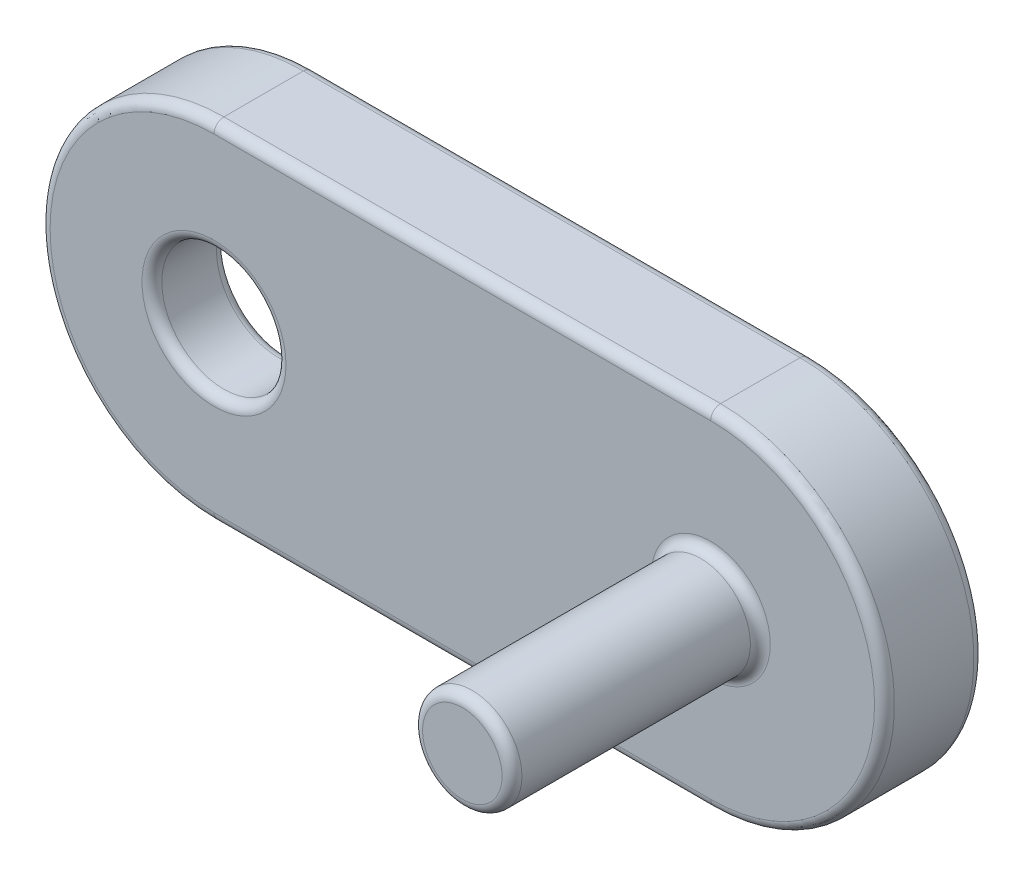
SolidWorks part; units mm, degrees
ref_plane "Face" through (0, 0, 0) normal (0, 0, 1) x (1, 0, 0)
ref_plane "Dessus" through (0, 0, 0) normal (0, 1, 0) x (1, 0, 0)
ref_plane "Droite" through (0, 0, 0) normal (1, 0, 0) x (0, 0, -1)
sketch "Esquisse1" plane through (0, 0, 0) normal (0, 0, 1) x (1, 0, 0)
  line L0 (0, 30.268) -> (0, -29.5682) construction
  line L1 (-5, 3.5) -> (5, 3.5)
  line L2 (-5, -3.5) -> (5, -3.5)
  arc A0 (-5, 3.5) -> (-5, -3.5) centre (-5, 0) ccw
  arc A1 (5, 3.5) -> (5, -3.5) centre (5, 0) cw
  point P10 (0, 3.5)
  point P13 (0, -3.5)
  dimension "D1" = 7
  dimension "D2" = 10
extrude "Extrusion1" add sketch "Esquisse1" along normal blind 2
sketch "Esquisse2" plane through (0, 0, 0) normal (0, 0, -1) x (-1, 0, 0)
  line L4 (5, 3) -> (-5, 3)
  line L5 (-5, -3) -> (5, -3)
  line L6 (5, 3) -> (-5, 3)
  line L7 (-5, -3) -> (5, -3)
  arc A4 (5, -3) -> (5, 3) centre (5, 0) ccw
  arc A5 (-5, 3) -> (-5, -3) centre (-5, 0) ccw
  arc A6 (5, -3) -> (5, 3) centre (5, 0) ccw
  arc A7 (-5, 3) -> (-5, -3) centre (-5, 0) ccw
  dimension "D1" = 0.5
extrude "Enlèv. mat.-Extru.1" cut sketch "Esquisse2" against normal blind 0.5
sketch "Esquisse3" plane through (0, 0, 0.5) normal (0, 0, -1) x (-1, 0, 0)
  circle A0 centre (5, 0) radius 1.25
  dimension "D1" = 2.5
extrude "Enlèv. mat.-Extru.2" cut sketch "Esquisse3" against normal through all
sketch "Esquisse4" plane through (0, 0, 2) normal (0, 0, 1) x (1, 0, 0)
  circle A0 centre (5, 0) radius 1
  dimension "D1" = 2
extrude "Extrusion2" add sketch "Esquisse4" along normal blind 5
fillet "Congé1" radius 0.2
